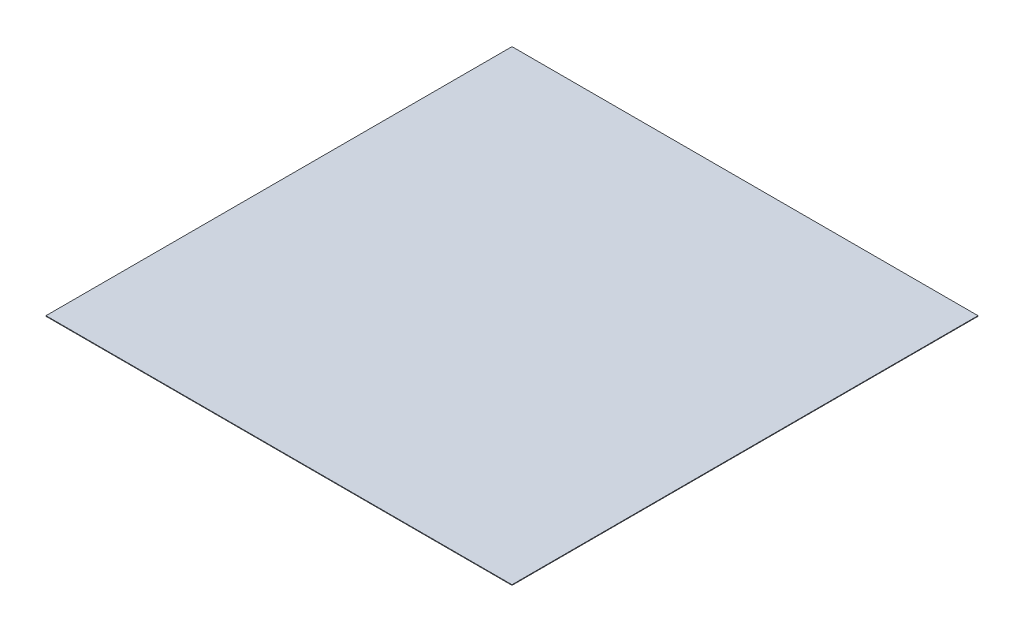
SolidWorks part; units mm, degrees
ref_plane "Front Plane" through (0, 0, 0) normal (0, 0, 1) x (1, 0, 0)
ref_plane "Top Plane" through (0, 0, 0) normal (0, 1, 0) x (1, 0, 0)
ref_plane "Right Plane" through (0, 0, 0) normal (1, 0, 0) x (0, 0, -1)
sketch "Sketch1" plane through (0, 0, 0) normal (1, 0, 0) x (0, 0, -1)
  line L1 (-10160, 12.7) -> (10160, 12.7)
  line L2 (-10160, 12.7) -> (-10160, -12.7)
  line L3 (-10160, -12.7) -> (10160, -12.7)
  line L4 (10160, 12.7) -> (10160, -12.7)
  line L5 (-10160, 12.7) -> (10160, -12.7) construction
  line L6 (-10160, -12.7) -> (10160, 12.7) construction
  point P0 (0, 0)
  dimension "D1" = 25.4
  dimension "D2" = 20320
extrude "Boss-Extrude1" add sketch "Sketch1" along normal mid plane 20320
